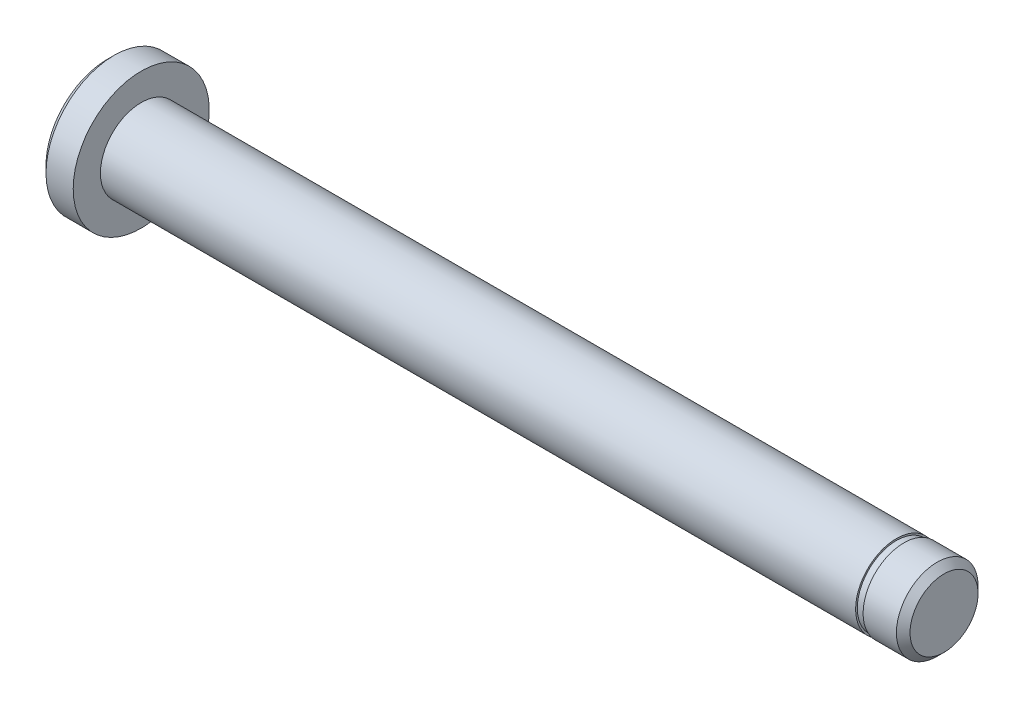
SolidWorks part; units mm, degrees
ref_plane "Plan de face" through (0, 0, 0) normal (0, 0, 1) x (1, 0, 0)
ref_plane "Plan de dessus" through (0, 0, 0) normal (0, 1, 0) x (1, 0, 0)
ref_plane "Plan de droite" through (0, 0, 0) normal (1, 0, 0) x (0, 0, -1)
sketch "Esquisse1" plane through (0, 0, 0) normal (0, 0, 1) x (1, 0, 0)
  line L0 (-49.6368, 0) -> (65.3921, 0) construction
  line L1 (-35.7171, 0) -> (-35.7171, 10)
  line L2 (-35.7171, 10) -> (-30.7171, 10)
  line L3 (-30.7171, 10) -> (-30.7171, 6)
  line L4 (-30.7171, 6) -> (80.2829, 6)
  line L5 (80.2829, 6) -> (80.2829, 5.75)
  line L6 (80.2829, 5.75) -> (81.3829, 5.75)
  line L7 (81.3829, 5.75) -> (81.3829, 6)
  line L8 (81.3829, 6) -> (87.2829, 6)
  line L9 (87.2829, 6) -> (87.2829, 0)
  line L10 (-35.7171, 0) -> (87.2829, 0)
  dimension "D1" = 6
  dimension "D2" = 10
  dimension "D3" = 5
  dimension "D4" = 111
  dimension "D5" = 118
  dimension "D6" = 5.75
  dimension "D7" = 6
  dimension "D8" = 1.1
revolve "Révolution1" add sketch "Esquisse1" angle 360 about L0
chamfer "Chanfrein1" distance 1 angle 45 1 edges at (87.2829, 0, 6)
chamfer "Chanfrein2" distance 1 angle 45 1 edges at (-35.7171, 0, 10)
